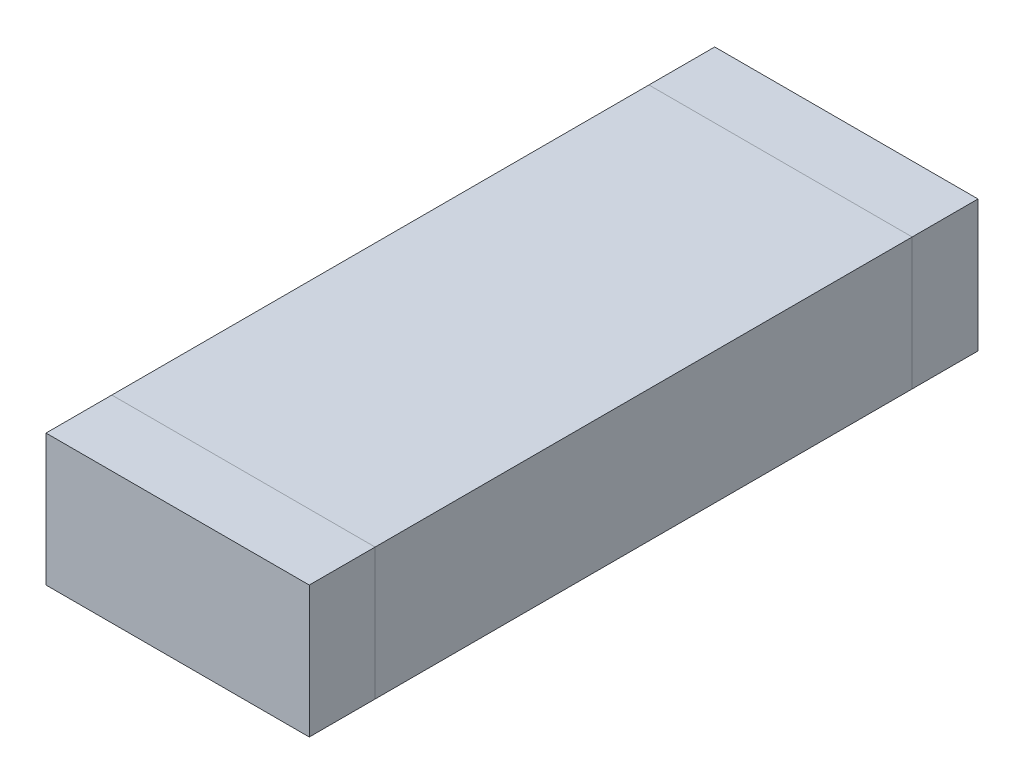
SolidWorks part; units mm, degrees
ref_plane "Front Plane" through (0, 0, 0) normal (0, 0, 1) x (1, 0, 0)
ref_plane "Top Plane" through (0, 0, 0) normal (0, 1, 0) x (1, 0, 0)
ref_plane "Right Plane" through (0, 0, 0) normal (1, 0, 0) x (0, 0, -1)
sketch "Sketch1" plane through (0, 0, 0) normal (0, 1, 0) x (1, 0, 0)
  line L1 (0.5, -1.27) -> (-0.5, -1.27)
  line L2 (0.5, -1.27) -> (0.5, 1.27)
  line L3 (0.5, 1.27) -> (-0.5, 1.27)
  line L4 (-0.5, -1.27) -> (-0.5, 1.27)
  line L5 (0.5, -1.27) -> (-0.5, 1.27) construction
  line L6 (0.5, 1.27) -> (-0.5, -1.27) construction
  point P0 (0, 0)
  dimension "D1" = 2.54
  dimension "D2" = 1
extrude "Extrude1" add sketch "Sketch1" along normal blind 0.5
sketch "Sketch2" plane through (0, 0.5, 0) normal (0, 1, 0) x (1, 0, 0)
  line L0 (-0.5, 1.27) -> (-0.5, -1.27) construction
  line L1 (0.5, -1.02) -> (-0.5, -1.02)
  line L2 (0.5, -1.02) -> (0.5, 1.02)
  line L3 (0.5, 1.02) -> (-0.5, 1.02)
  line L4 (-0.5, -1.02) -> (-0.5, 1.02)
  line L5 (0.5, -1.02) -> (-0.5, 1.02) construction
  line L6 (0.5, 1.02) -> (-0.5, -1.02) construction
  line L7 (0.5, 1.27) -> (-0.5, 1.27) construction
  point P0 (0, 0)
  dimension "D1" = 0.25
